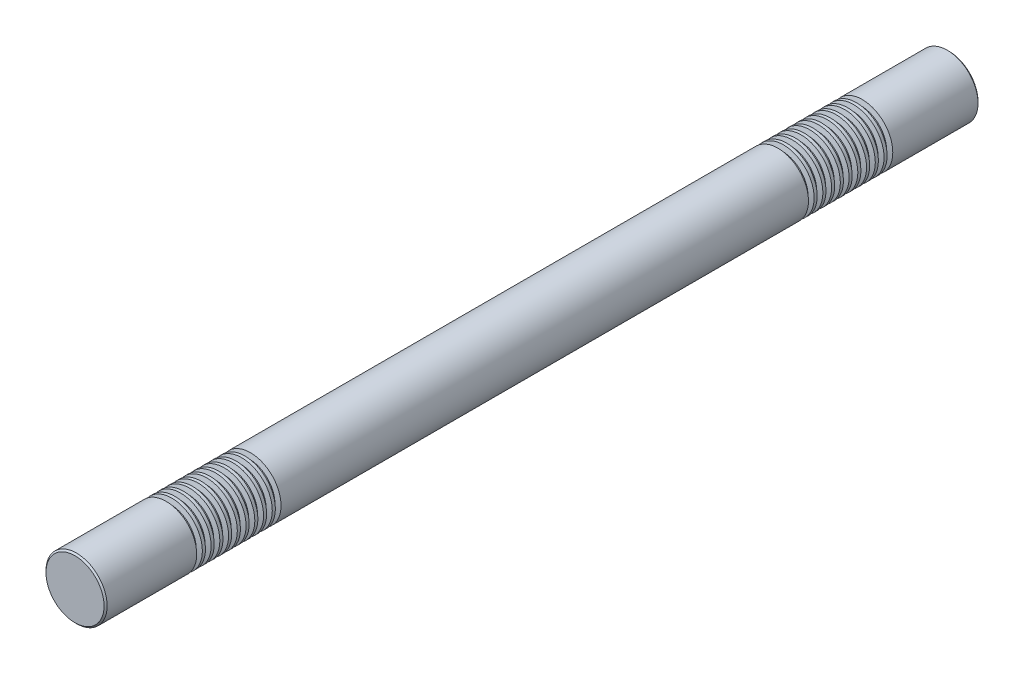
SolidWorks part; units mm, degrees
ref_plane "Front Plane" through (0, 0, 0) normal (0, 0, 1) x (1, 0, 0)
ref_plane "Top Plane" through (0, 0, 0) normal (0, 1, 0) x (1, 0, 0)
ref_plane "Right Plane" through (0, 0, 0) normal (1, 0, 0) x (0, 0, -1)
sketch "Sketch1" plane through (0, 0, 0) normal (0, 0, 1) x (1, 0, 0)
  circle A0 centre (0, 0) radius 35
  dimension "D1" = 70
extrude "Boss-Extrude1" add sketch "Sketch1" along normal mid plane 1000
chamfer "Chamfer1" distance 1.75 angle 45 2 edges at (35, 0, -500) (35, 0, 500)
sketch "Sketch2" plane through (0, 0, 0) normal (1, 0, 0) x (0, 0, -1)
  line L0 (400.7369, 35) -> (394.2631, 35)
  line L1 (498.25, 35) -> (-498.25, 35) construction
  line L2 (394.2631, 35) -> (395.7369, 29.5)
  line L3 (395.7369, 29.5) -> (399.2631, 29.5)
  line L4 (399.2631, 29.5) -> (400.7369, 35)
  line L5 (500, -33.25) -> (500, 33.25) construction
  point P4 (397.5, 35)
  point P7 (397.5, 29.5)
  point P8 (400, 32.25)
  point P9 (395, 32.25)
  dimension "D1" = 5
  dimension "D2" = 100
  dimension "D3" = 5.5
  dimension "D4" = 30
revolve "Cut-Revolve1" cut sketch "Sketch2" angle 360 about axis through (0, 0, 500) along (0, 0, -1)
pattern_linear "LPattern1" count 10 spacing 10 along (0, 0, 1) of "Cut-Revolve1"
pattern_linear "LPattern2" count 2 spacing 700 along (0, 0, 1) of "Cut-Revolve1", "LPattern1"
